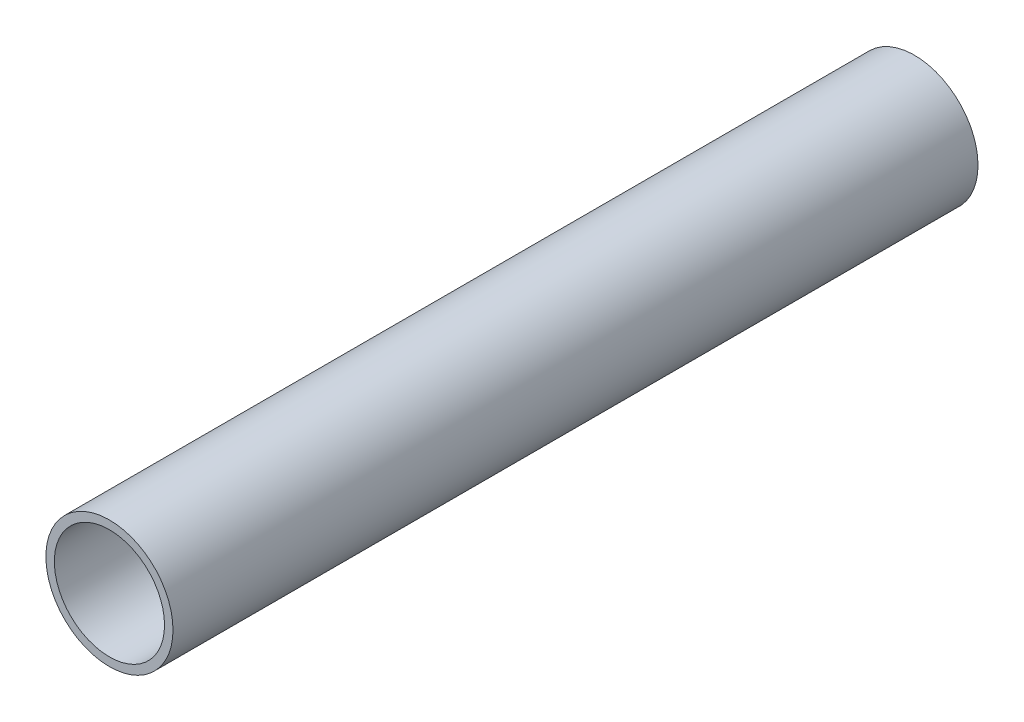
SolidWorks part; units mm, degrees
ref_plane "Front Plane" through (0, 0, 0) normal (0, 0, 1) x (1, 0, 0)
ref_plane "Top Plane" through (0, 0, 0) normal (0, 1, 0) x (1, 0, 0)
ref_plane "Right Plane" through (0, 0, 0) normal (1, 0, 0) x (0, 0, -1)
sketch "Sketch1" plane through (0, 0, 0) normal (0, 0, 1) x (1, 0, 0)
  circle A0 centre (0, 0) radius 15
extrude "Boss-Extrude1" add sketch "Sketch1" against normal blind 190
sketch "Sketch2" plane through (0, 0, 0) normal (0, 0, 1) x (1, 0, 0)
  circle A0 centre (0, 0) radius 12.5
extrude "Cut-Extrude1" cut sketch "Sketch2" against normal blind 210
sketch "Sketch3" plane through (0, 0, 0) normal (0, 0, 1) x (1, 0, 0)
  circle A0 centre (0, 0) radius 13
extrude "Cut-Extrude2" cut sketch "Sketch3" against normal through all
